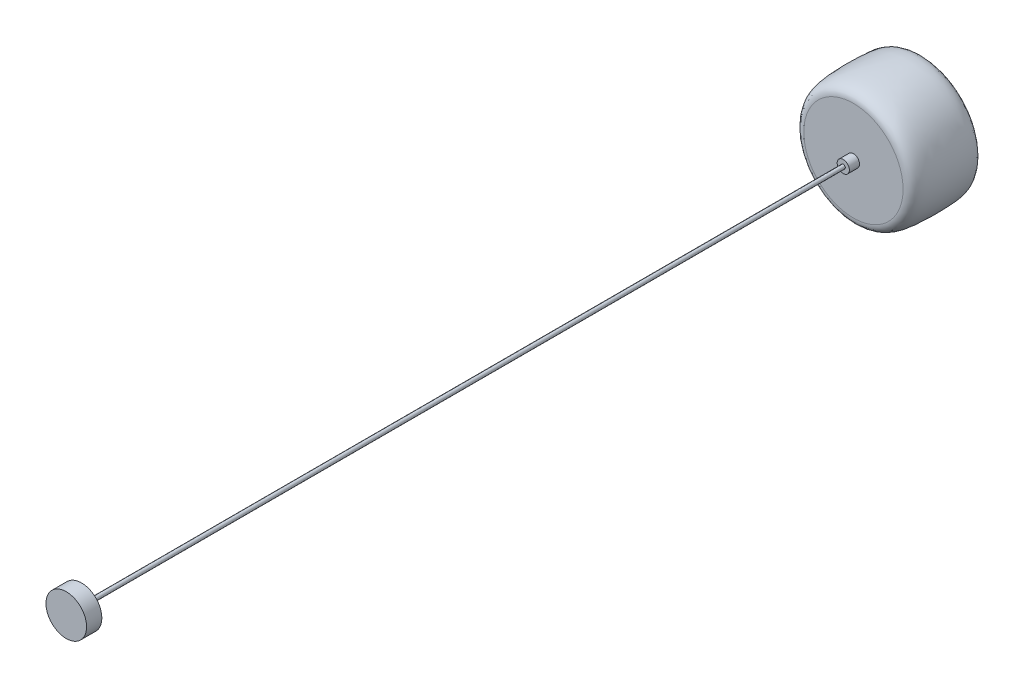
SolidWorks part; units mm, degrees
ref_plane "Alzado" through (0, 0, 0) normal (0, 0, 1) x (1, 0, 0)
ref_plane "Planta" through (0, 0, 0) normal (0, 1, 0) x (1, 0, 0)
ref_plane "Vista lateral" through (0, 0, 0) normal (1, 0, 0) x (0, 0, -1)
imported_body "Manises Sobremesa.igs-1/Manises Sobremesa63.igs-1-solid1"
ref_plane "Plano1" through (0, 0, 538) normal (0, 0, 1) x (1, 0, 0)
sketch "Croquis1" plane through (0, 0, 538) normal (0, 0, 1) x (1, 0, 0)
  circle A0 centre (-105, 0) radius 12
  dimension "D1" = 24
extrude "Saliente-Extruir1" add sketch "Croquis1" along normal blind 20
sketch "Croquis2" plane through (0, 0, 558) normal (0, 0, 1) x (1, 0, 0)
  circle A0 centre (-105, 0) radius 4
  dimension "D1" = 8
extrude "Saliente-Extruir2" add sketch "Croquis2" along normal blind 1500
sketch "Croquis3" plane through (0, 0, 2058) normal (0, 0, 1) x (1, 0, 0)
  circle A0 centre (-105, 0) radius 40
  dimension "D1" = 80
extrude "Saliente-Extruir3" add sketch "Croquis3" along normal blind 30
